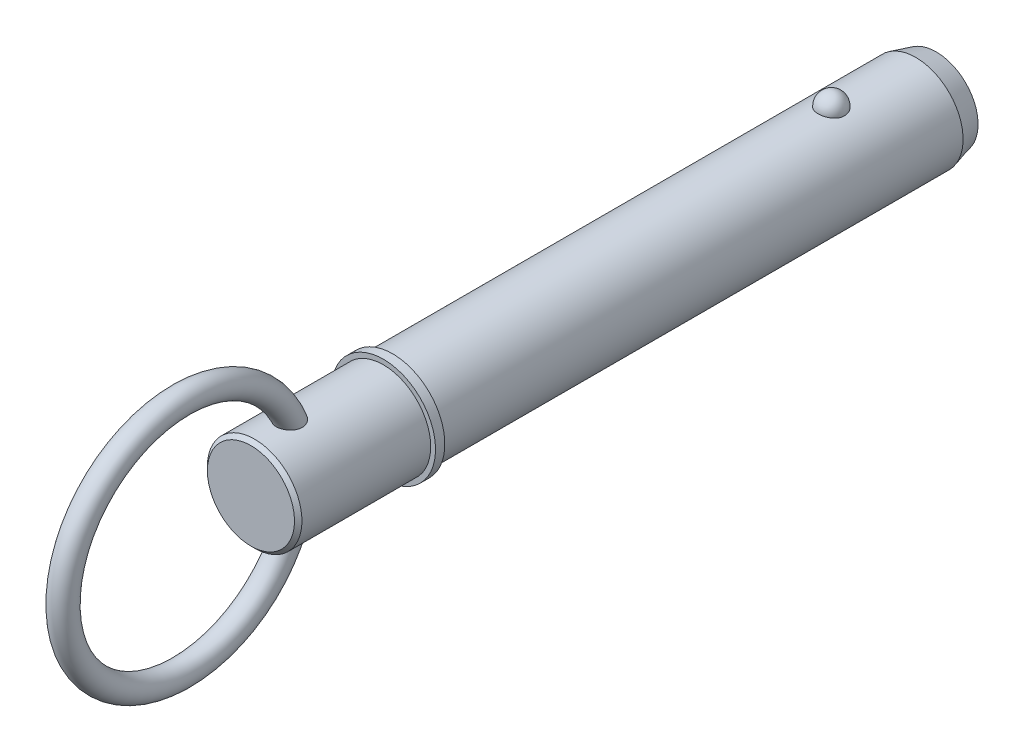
SolidWorks part; units mm, degrees
ref_plane "Front Plane" through (0, 0, 0) normal (0, 0, 1) x (1, 0, 0)
ref_plane "Top Plane" through (0, 0, 0) normal (0, 1, 0) x (1, 0, 0)
ref_plane "Right Plane" through (0, 0, 0) normal (1, 0, 0) x (0, 0, -1)
sketch "Sketch2" plane through (0, 0, 0) normal (0, 0, 1) x (1, 0, 0)
  circle A0 centre (0, 0) radius 12.7
  point P3 (0, 12.7)
  dimension "D1" = 25.4
extrude "Boss-Extrude1" add sketch "Sketch2" along normal blind 114.3
sketch "Sketch3" plane through (0, 0, 0) normal (0, 0, -1) x (-1, 0, 0)
  circle A0 centre (0, 0) radius 12.7
  dimension "D1" = 25.4
extrude "Boss-Extrude2" add sketch "Sketch3" along normal blind 31.75
chamfer "Chamfer1" distance 5.5 angle 15 1 edges at (-12.7, 0, -31.75)
sketch "Sketch18" plane through (0, 0, 0) normal (1, 0, 0) x (0, 0, -1)
  line L0 (26.25, 12.7) -> (-114.3, 12.7) construction
  line L1 (3.56, 16.26) -> (3.56, 9.14)
  line L2 (-114.3, -12.7) -> (26.25, -12.7) construction
  arc A0 (3.56, 16.26) -> (3.56, 9.14) centre (3.56, 12.7) ccw
  point P4 (0, 12.7)
  dimension "D1" = 28.96
revolve "Revolve1" add sketch "Sketch18" angle 360 about L1
sketch "Sketch19" plane through (0, 0, 0) normal (1, 0, 0) x (0, 0, -1)
  line L0 (-33.7288, 0) -> (-46.4542, 0) construction
sketch "Sketch20" plane through (0, 0, 0) normal (1, 0, 0) x (0, 0, -1)
  line L0 (-114.3, 0) -> (-114.3, 14)
  line L1 (-114.3, 12.7) -> (-114.3, -12.7) construction
  line L2 (-114.3, 14) -> (-116.8, 14)
  line L3 (-116.8, 14) -> (-116.8, 0)
  line L4 (-33.7288, 0) -> (-46.4542, 0) construction
  line L5 (-116.8, 0) -> (-114.3, 0)
  dimension "D1" = 14
  dimension "D2" = 2.5
revolve "Revolve2" add sketch "Sketch20" angle 360 about L0
sketch "Sketch21" plane through (0, 0, 114.3) normal (0, 0, -1) x (-1, 0, 0)
  circle A0 centre (0, 0) radius 12.7
  dimension "D1" = 25.4
extrude "Boss-Extrude3" add sketch "Sketch21" against normal blind 38.1
chamfer "Chamfer2" distance 1 angle 45 1 edges at (-12.7, 0, 152.4)
sketch "Sketch23" plane through (0, 0, 0) normal (1, 0, 0) x (0, 0, -1)
  line L0 (-152.4, 11.7) -> (-152.4, -11.7) construction
  circle A0 centre (-171.15, 0) radius 31.75
  point P2 (-139.4, 0)
  dimension "D1" = 63.5
  dimension "D2" = 13
sketch "Sketch24" plane through (0, 0, 0) normal (0, 1, 0) x (1, 0, 0)
  circle A0 centre (0, -139.4) radius 3.25
  dimension "D1" = 6.5
sweep "Sweep1" add profiles "Sketch24" path "Sketch23"
